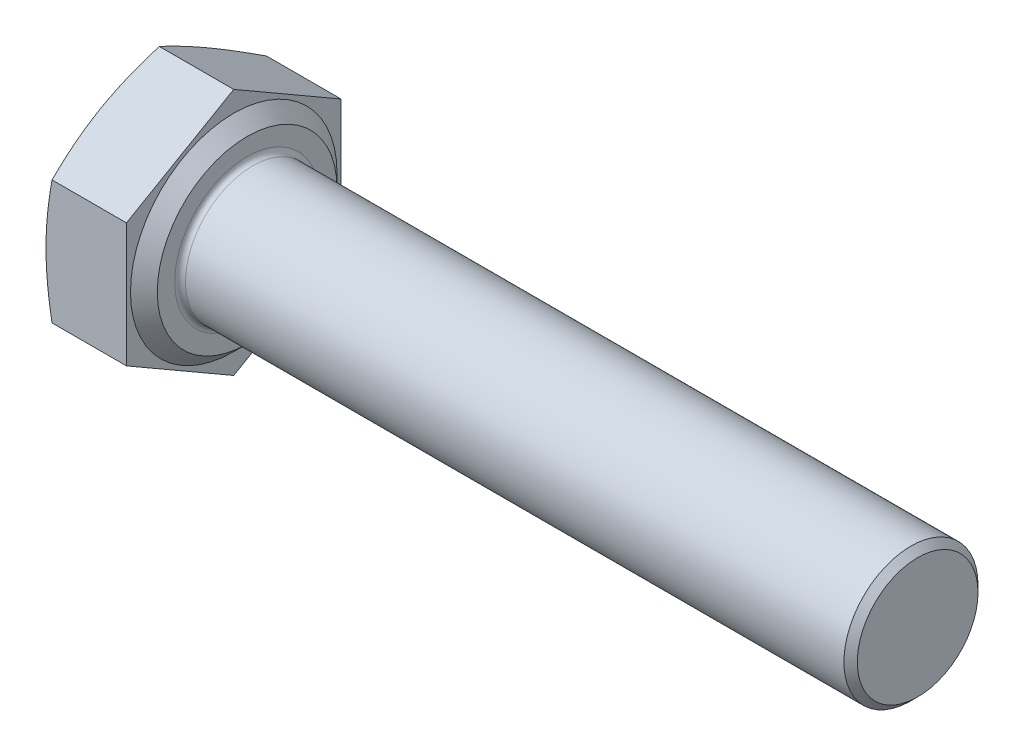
SolidWorks part; units mm, degrees
ref_plane "Front" through (0, 0, 0) normal (0, 0, 1) x (1, 0, 0)
ref_plane "Top" through (0, 0, 0) normal (0, 1, 0) x (1, 0, 0)
ref_plane "Right" through (0, 0, 0) normal (1, 0, 0) x (0, 0, -1)
sketch "Sketch2" plane through (0, 0, 0) normal (1, 0, 0) x (0, 0, -1)
  line L1 (0, -4.6188) -> (4, -2.3094)
  line L2 (4, -2.3094) -> (4, 2.3094)
  line L3 (4, 2.3094) -> (0, 4.6188)
  line L4 (0, 4.6188) -> (-4, 2.3094)
  line L5 (-4, 2.3094) -> (-4, -2.3094)
  line L6 (-4, -2.3094) -> (0, -4.6188)
  circle A0 centre (0, 0) radius 4 construction
  dimension "s" = 8
extrude "BaseHead" add sketch "Sketch2" along normal blind 3.5
sketch "Sketch3" plane through (0, 0, 0) normal (0, 0, 1) x (1, 0, 0)
  line L0 (3.5, 4.6188) -> (3.5, 3.35)
  line L2 (3.5, 3.35) -> (3, 3.85)
  line L3 (3, 3.85) -> (3, 4.6188)
  line L5 (3, 4.6188) -> (3.5, 4.6188)
  line L6 (-0.9571, 0) -> (7.6478, 0) construction
  line L7 (3.5, 4.6188) -> (0, 4.6188) construction
  dimension "D1" = 45
  dimension "c" = 0.5
  dimension "dw" = 6.7
revolve "BearingFace" cut sketch "Sketch3" angle 360 about L6
sketch "Sketch4" plane through (0, 0, 0) normal (0, 0, 1) x (1, 0, 0)
  line L0 (-0.4935, 0) -> (3.5626, 0) construction
  line L2 (0, 4.6188) -> (0.2252, 4.6188)
  line L4 (0.2252, 4.6188) -> (0, 4)
  line L6 (0, 4) -> (0, 4.6188)
  line L7 (3, 4.6188) -> (0, 4.6188) construction
  dimension "D1" = 20
  dimension "D2" = 8
revolve "HeadChamfer" cut sketch "Sketch4" angle 360 about L0
ref_plane "Plane1" through (12.5, 0, 0) normal (1, 0, 0) x (0, 0, -1)
sketch "Sketch5" plane through (3.5, 0, 0) normal (1, 0, 0) x (0, 0, -1)
  circle A0 centre (0, 0) radius 2.5
  dimension "d" = 5
extrude "BaseBody" add sketch "Sketch5" along normal blind 25
chamfer "Chamfer1" distance 0.25 angle 45 1 edges at (28.5, 0, -2.5)
fillet "HeadFillet" radius 0.2 1 edges at (3.5, 0, -2.5)
equation "\"D2@Sketch4\" = \"s@Sketch2\""
equation "\"D1@Chamfer1\" = 0.05 * \"d@Sketch5\""
equation "\"D1@ThreadCosmetic1\" = \"l@BaseBody\" - \"lg@Plane1\""
